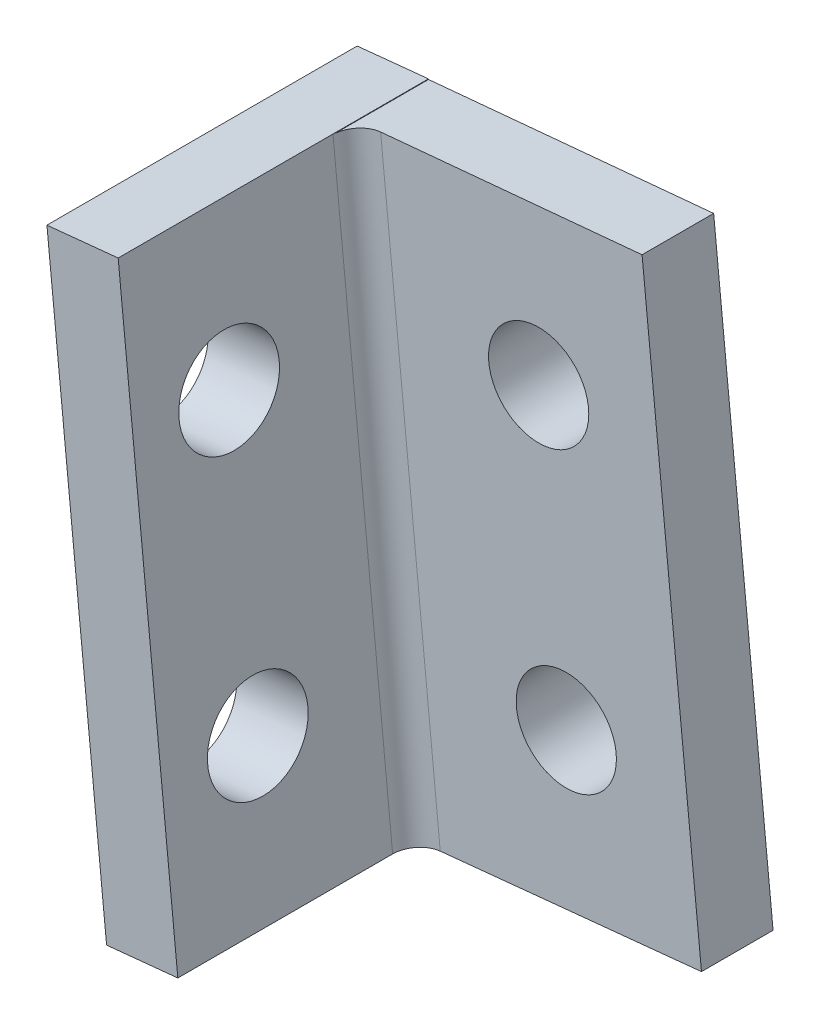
SolidWorks part; units mm, degrees
ref_plane "Front Plane" through (0, 0, 0) normal (0, 0, 1) x (1, 0, 0)
ref_plane "Top Plane" through (0, 0, 0) normal (0, 1, 0) x (1, 0, 0)
ref_plane "Right Plane" through (0, 0, 0) normal (1, 0, 0) x (0, 0, -1)
sketch "Sketch1" plane through (0, 0, 0) normal (0, 0, 1) x (1, 0, 0)
  line L0 (-105, 44.7368) -> (-102.5, 19.8621)
  line L1 (-102.5, 19.8621) -> (-87.5752, 21.3621)
  line L2 (-87.5752, 21.3621) -> (-90.0649, 46.1302)
  line L3 (-90.0649, 46.1302) -> (-105, 44.7368)
  line L4 (-103.75, 32.2995) -> (-88.82, 33.7461) construction
  line L5 (-94.3968, 39.2339) -> (-93.2395, 27.2898) construction
  arc A0 (105, 44.7368) -> (-105, 44.7368) centre (0, -1000) ccw construction
  circle A2 centre (-94.3968, 39.2339) radius 2.1
  circle A3 centre (-93.2395, 27.2898) radius 2.1
  point P11 (0, 0)
  point P17 (-110.7999, 25.0506)
  point P18 (-94.3968, 39.2339)
  point P19 (-93.2395, 27.2898)
  dimension "D2" = 4.2
  dimension "D1" = 15
  dimension "D3" = 6
  dimension "D4" = 5
  dimension "D5" = 25
extrude "Boss-Extrude1" add sketch "Sketch1" along normal blind 3
sketch "Sketch3" plane through (-99.4987, -10, 0) normal (-0.995, -0.1, 0) x (0, 0, 1)
  line L0 (0, 55.0126) -> (0, 30.0126) construction
  line L1 (0, 30.0126) -> (13, 30.0126)
  line L2 (0, 30.0126) -> (0, 55.0126)
  line L3 (0, 55.0126) -> (13, 55.0126)
  line L4 (13, 30.0126) -> (13, 55.0126)
  line L5 (3, 30.0126) -> (0, 30.0126) construction
  line L6 (3, 55.0126) -> (0, 55.0126) construction
  line L7 (3, 55.0126) -> (3, 30.0126) construction
  line L8 (3, 42.5126) -> (13, 42.5126) construction
  circle A0 centre (9, 36.5126) radius 2.1
  circle A1 centre (9, 48.5126) radius 2.1
  dimension "D2" = 4.2
  dimension "D1" = 10
  dimension "6" = 6
  dimension "D4" = 6
extrude "Boss-Extrude2" add sketch "Sketch3" against normal blind 3
fillet "Fillet1" radius 1 1 edges at (-100.764, 32.5888, 3)
